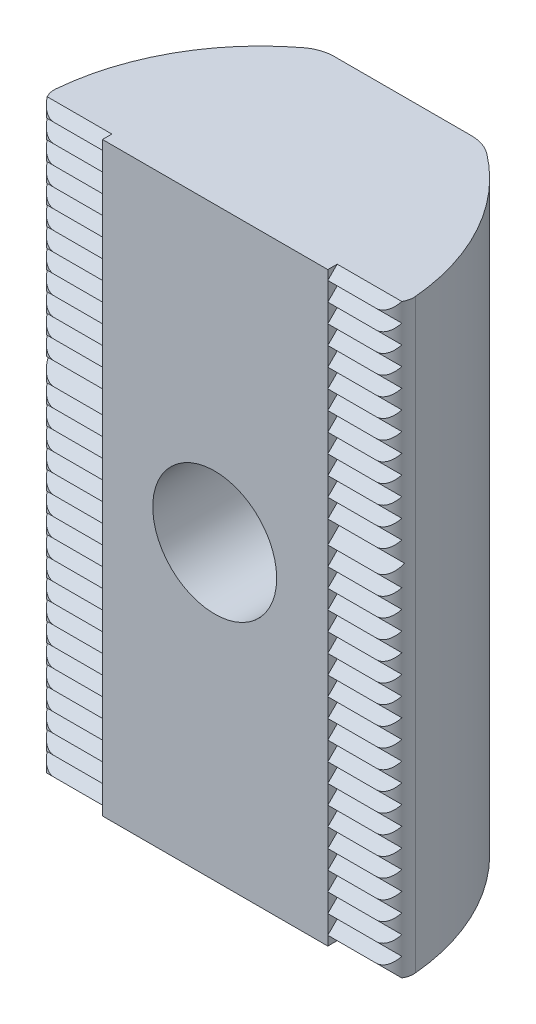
SolidWorks part; units mm, degrees
ref_plane "正面" through (0, 0, 0) normal (0, 0, 1) x (1, 0, 0)
ref_plane "平面" through (0, 0, 0) normal (0, 1, 0) x (1, 0, 0)
ref_plane "右側面" through (0, 0, 0) normal (1, 0, 0) x (0, 0, -1)
sketch "ｽｹｯﾁ1" plane through (0, 0, 0) normal (0, -1, 0) x (1, 0, 0)
  line L8 (-4.2884, 0) -> (4.2884, 0)
  line L9 (1.8306, -5) -> (-1.8306, -5)
  arc A8 (-4.7865, -0.544) -> (-2.4348, -4.7969) centre (1.1902, -0.0157) ccw
  arc A9 (-2.4348, -4.7969) -> (-1.8306, -5) centre (-1.8306, -4) ccw
  arc A10 (-4.2884, 0) -> (-4.7865, -0.544) centre (-4.2884, -0.5) ccw
  arc A11 (2.4348, -4.7969) -> (4.7865, -0.544) centre (-1.1902, -0.0157) ccw
  arc A12 (1.8306, -5) -> (2.4348, -4.7969) centre (1.8306, -4) ccw
  arc A13 (4.7865, -0.544) -> (4.2884, 0) centre (4.2884, -0.5) ccw
extrude "押し出し1" add sketch "ｽｹｯﾁ1" along normal mid plane 15.6
hole_wizard "M4x0.7 ねじ穴1" positions "ｽｹｯﾁ3" profile "ｽｹｯﾁ2" tap size "M4x0.7" standard "JIS"
sketch "ｽｹｯﾁ3" plane through (1.3374, 5.2145, 0) normal (0, 0, 1) x (1, 0, 0)
  line L1 (2.951, -13.0145) -> (-5.6258, -13.0145) construction
  line L3 (2.951, -13.0145) -> (2.951, 2.5855) construction
  point P0 (-1.349, -5.2145)
  dimension "D1" = 7.8
  dimension "D2" = 4.3
sketch "ｽｹｯﾁ2" plane through (-0.0116, 0, 0) normal (1, 0, 0) x (0, -1, 0)
  line L0 (0, 0) -> (0, 5)
  line L1 (0, 5) -> (1.65, 5)
  line L2 (1.65, 5) -> (1.65, 0)
  line L5 (1.65, 0) -> (0, 0)
  line L11 (0, -6.35) -> (0, 107.95) construction
  dimension "次ｻｰﾌｪｽまでのねじ下穴ﾄﾞﾘﾙの直径" = 3.3
  dimension "次ｻｰﾌｪｽまでのねじ下穴ﾄﾞﾘﾙの深さ" = 5
ref_plane "平面1" through (3, 0, 0) normal (1, 0, 0) x (0, 0, -1)
ref_plane "平面2" through (-3, 0, 0) normal (1, 0, 0) x (0, 0, -1)
sketch "ｽｹｯﾁ4" plane through (3, 0, 0) normal (1, 0, 0) x (0, 0, -1)
  line L0 (0.25, -7.8) -> (-2.0124, -7.8)
  line L1 (-2.0124, -7.8) -> (-2.0124, 7.8)
  line L2 (-2.0124, 7.8) -> (0.25, 7.8)
  line L3 (0, -7.05) -> (0.25, -6.8)
  line L6 (0.25, -7.3) -> (0, -7.05)
  line L7 (0.25, -7.8) -> (0, -7.55)
  line L8 (0, -7.55) -> (0.25, -7.3)
  line L9 (0, 4.55) -> (0.25, 4.8)
  line L10 (0.25, -1.3) -> (0, -1.05)
  line L13 (0.25, -4.3) -> (0, -4.05)
  line L14 (0, -6.55) -> (0.25, -6.3)
  line L15 (0.25, -6.8) -> (0, -6.55)
  line L16 (0, -4.55) -> (0.25, -4.3)
  line L17 (0.25, -5.3) -> (0, -5.05)
  line L18 (0, -6.05) -> (0.25, -5.8)
  line L19 (0.25, -6.3) -> (0, -6.05)
  line L20 (0.25, -5.8) -> (0, -5.55)
  line L21 (0, -5.55) -> (0.25, -5.3)
  line L22 (0, -5.05) -> (0.25, -4.8)
  line L23 (0.25, -4.8) -> (0, -4.55)
  line L24 (0, -2.55) -> (0.25, -2.3)
  line L25 (0.25, -3.3) -> (0, -3.05)
  line L26 (0, -4.05) -> (0.25, -3.8)
  line L27 (0.25, -3.8) -> (0, -3.55)
  line L28 (0, -3.55) -> (0.25, -3.3)
  line L29 (0, -3.05) -> (0.25, -2.8)
  line L30 (0.25, -2.8) -> (0, -2.55)
  line L31 (0, -2.05) -> (0.25, -1.8)
  line L32 (0.25, -2.3) -> (0, -2.05)
  line L33 (0.25, -1.8) -> (0, -1.55)
  line L34 (0, -1.55) -> (0.25, -1.3)
  line L37 (0, -0.55) -> (0.25, -0.3)
  line L38 (0, -1.05) -> (0.25, -0.8)
  line L39 (0.25, -0.8) -> (0, -0.55)
  line L40 (0, 1.45) -> (0.3, 1.75)
  line L41 (0.25, 0.7) -> (0, 0.95)
  line L42 (0, -0.05) -> (0.25, 0.2)
  line L43 (0.25, -0.3) -> (0, -0.05)
  line L44 (0.25, 0.2) -> (0, 0.45)
  line L45 (0, 0.45) -> (0.25, 0.7)
  line L46 (0, 0.95) -> (0.25, 1.2)
  line L47 (0.25, 1.2) -> (0, 1.45)
  line L48 (0, 3.55) -> (0.25, 3.8)
  line L49 (0.25, 2.8) -> (0, 3.05)
  line L50 (0, 2.05) -> (0.25, 2.3)
  line L51 (0.3, 1.75) -> (0, 2.05)
  line L52 (0.25, 2.3) -> (0, 2.55)
  line L53 (0, 2.55) -> (0.25, 2.8)
  line L54 (0, 3.05) -> (0.25, 3.3)
  line L55 (0.25, 3.3) -> (0, 3.55)
  line L56 (0, 4.05) -> (0.25, 4.3)
  line L57 (0.25, 3.8) -> (0, 4.05)
  line L58 (0.25, 4.3) -> (0, 4.55)
  line L60 (0.25, 7.3) -> (0, 7.55)
  line L61 (0, 5.55) -> (0.25, 5.8)
  line L62 (0.25, 4.8) -> (0, 5.05)
  line L63 (0, 5.05) -> (0.25, 5.3)
  line L64 (0.25, 5.3) -> (0, 5.55)
  line L65 (0, 7.05) -> (0.25, 7.3)
  line L66 (0.25, 6.8) -> (0, 7.05)
  line L67 (0.25, 6.3) -> (0, 6.55)
  line L68 (0, 6.55) -> (0.25, 6.8)
  line L69 (0.25, 5.8) -> (0, 6.05)
  line L70 (0, 6.05) -> (0.25, 6.3)
  line L71 (0, 7.55) -> (0.25, 7.8)
extrude "押し出し2" cut sketch "ｽｹｯﾁ4" along normal through all contours L60 L71 L2 L1 L0 L7 L8 L6 L3 L15 L14 L19 L18 L20 L21 L17 L22 L23 L16 L13 L26 L27 L28 L25 L29 L30 L24 L32 L31 L33 L34 L10 L38 L39 L37 L43 L42 L44 L45 L41 L46 L47 L40 L51 L50 L52 L53 L49 L54 L55 L48
sketch "ｽｹｯﾁ5" plane through (-3, 0, 0) normal (1, 0, 0) x (0, 0, -1)
  line L1 (-2.0124, 7.8) -> (0.25, 7.8) construction
  line L2 (-2.0124, -7.8) -> (-2.0124, 7.8) construction
  line L3 (0.25, -7.8) -> (-2.0124, -7.8) construction
  line L4 (0.25, -7.8) -> (0, -7.55) construction
  line L5 (0, -7.55) -> (0.25, -7.3) construction
  line L6 (0.25, -7.3) -> (0, -7.05) construction
  line L7 (0, -7.05) -> (0.25, -6.8) construction
  line L8 (0.25, -6.8) -> (0, -6.55) construction
  line L9 (0, -6.55) -> (0.25, -6.3) construction
  line L10 (0.25, -6.3) -> (0, -6.05) construction
  line L11 (0, -6.05) -> (0.25, -5.8) construction
  line L12 (0.25, -5.8) -> (0, -5.55) construction
  line L13 (0, -5.55) -> (0.25, -5.3) construction
  line L14 (0.25, -5.3) -> (0, -5.05) construction
  line L15 (0, -5.05) -> (0.25, -4.8) construction
  line L16 (0.25, -4.8) -> (0, -4.55) construction
  line L17 (0, -4.55) -> (0.25, -4.3) construction
  line L18 (0.25, -4.3) -> (0, -4.05) construction
  line L19 (0, -4.05) -> (0.25, -3.8) construction
  line L20 (0.25, -3.8) -> (0, -3.55) construction
  line L21 (0, -3.55) -> (0.25, -3.3) construction
  line L22 (0.25, -3.3) -> (0, -3.05) construction
  line L23 (0, -3.05) -> (0.25, -2.8) construction
  line L24 (0.25, -2.8) -> (0, -2.55) construction
  line L25 (0, -2.55) -> (0.25, -2.3) construction
  line L26 (0.25, -2.3) -> (0, -2.05) construction
  line L27 (0, -2.05) -> (0.25, -1.8) construction
  line L28 (0.25, -1.8) -> (0, -1.55) construction
  line L29 (0, -1.55) -> (0.25, -1.3) construction
  line L30 (0.25, -1.3) -> (0, -1.05) construction
  line L31 (0, -1.05) -> (0.25, -0.8) construction
  line L32 (0.25, -0.8) -> (0, -0.55) construction
  line L33 (0, -0.55) -> (0.25, -0.3) construction
  line L34 (0.25, -0.3) -> (0, -0.05) construction
  line L35 (0, -0.05) -> (0.25, 0.2) construction
  line L36 (0.25, 0.2) -> (0, 0.45) construction
  line L37 (0, 0.45) -> (0.25, 0.7) construction
  line L38 (0.25, 0.7) -> (0, 0.95) construction
  line L39 (0, 0.95) -> (0.25, 1.2) construction
  line L40 (0.25, 1.2) -> (0, 1.45) construction
  line L41 (0, 1.45) -> (0.3, 1.75) construction
  line L42 (0.3, 1.75) -> (0, 2.05) construction
  line L43 (0, 2.05) -> (0.25, 2.3) construction
  line L44 (0.25, 2.3) -> (0, 2.55) construction
  line L45 (0, 2.55) -> (0.25, 2.8) construction
  line L46 (0.25, 2.8) -> (0, 3.05) construction
  line L47 (0, 3.05) -> (0.25, 3.3) construction
  line L48 (0.25, 3.3) -> (0, 3.55) construction
  line L49 (0, 3.55) -> (0.25, 3.8) construction
  line L50 (0.25, 3.8) -> (0, 4.05) construction
  line L51 (0, 4.05) -> (0.25, 4.3) construction
  line L52 (0.25, 4.3) -> (0, 4.55) construction
  line L53 (0, 4.55) -> (0.25, 4.8) construction
  line L54 (0.25, 4.8) -> (0, 5.05) construction
  line L55 (0, 5.05) -> (0.25, 5.3) construction
  line L56 (0.25, 5.3) -> (0, 5.55) construction
  line L57 (0, 5.55) -> (0.25, 5.8) construction
  line L58 (0.25, 5.8) -> (0, 6.05) construction
  line L59 (0, 6.05) -> (0.25, 6.3) construction
  line L60 (0.25, 6.3) -> (0, 6.55) construction
  line L61 (0, 6.55) -> (0.25, 6.8) construction
  line L62 (0.25, 6.8) -> (0, 7.05) construction
  line L63 (0, 7.05) -> (0.25, 7.3) construction
  line L64 (0.25, 7.3) -> (0, 7.55) construction
  line L65 (0, 7.55) -> (0.25, 7.8) construction
  line L67 (-2.0124, 7.8) -> (0.25, 7.8)
  line L68 (-2.0124, -7.8) -> (-2.0124, 7.8)
  line L69 (0.25, -7.8) -> (-2.0124, -7.8)
  line L70 (0.25, -7.8) -> (0, -7.55)
  line L71 (0, -7.55) -> (0.25, -7.3)
  line L72 (0.25, -7.3) -> (0, -7.05)
  line L73 (0, -7.05) -> (0.25, -6.8)
  line L74 (0.25, -6.8) -> (0, -6.55)
  line L75 (0, -6.55) -> (0.25, -6.3)
  line L76 (0.25, -6.3) -> (0, -6.05)
  line L77 (0, -6.05) -> (0.25, -5.8)
  line L78 (0.25, -5.8) -> (0, -5.55)
  line L79 (0, -5.55) -> (0.25, -5.3)
  line L80 (0.25, -5.3) -> (0, -5.05)
  line L81 (0, -5.05) -> (0.25, -4.8)
  line L82 (0.25, -4.8) -> (0, -4.55)
  line L83 (0, -4.55) -> (0.25, -4.3)
  line L84 (0.25, -4.3) -> (0, -4.05)
  line L85 (0, -4.05) -> (0.25, -3.8)
  line L86 (0.25, -3.8) -> (0, -3.55)
  line L87 (0, -3.55) -> (0.25, -3.3)
  line L88 (0.25, -3.3) -> (0, -3.05)
  line L89 (0, -3.05) -> (0.25, -2.8)
  line L90 (0.25, -2.8) -> (0, -2.55)
  line L91 (0, -2.55) -> (0.25, -2.3)
  line L92 (0.25, -2.3) -> (0, -2.05)
  line L93 (0, -2.05) -> (0.25, -1.8)
  line L94 (0.25, -1.8) -> (0, -1.55)
  line L95 (0, -1.55) -> (0.25, -1.3)
  line L96 (0.25, -1.3) -> (0, -1.05)
  line L97 (0, -1.05) -> (0.25, -0.8)
  line L98 (0.25, -0.8) -> (0, -0.55)
  line L99 (0, -0.55) -> (0.25, -0.3)
  line L100 (0.25, -0.3) -> (0, -0.05)
  line L101 (0, -0.05) -> (0.25, 0.2)
  line L102 (0.25, 0.2) -> (0, 0.45)
  line L103 (0, 0.45) -> (0.25, 0.7)
  line L104 (0.25, 0.7) -> (0, 0.95)
  line L105 (0, 0.95) -> (0.25, 1.2)
  line L106 (0.25, 1.2) -> (0, 1.45)
  line L107 (0, 1.45) -> (0.3, 1.75)
  line L108 (0.3, 1.75) -> (0, 2.05)
  line L109 (0, 2.05) -> (0.25, 2.3)
  line L110 (0.25, 2.3) -> (0, 2.55)
  line L111 (0, 2.55) -> (0.25, 2.8)
  line L112 (0.25, 2.8) -> (0, 3.05)
  line L113 (0, 3.05) -> (0.25, 3.3)
  line L114 (0.25, 3.3) -> (0, 3.55)
  line L115 (0, 3.55) -> (0.25, 3.8)
  line L116 (0.25, 3.8) -> (0, 4.05)
  line L117 (0, 4.05) -> (0.25, 4.3)
  line L118 (0.25, 4.3) -> (0, 4.55)
  line L119 (0, 4.55) -> (0.25, 4.8)
  line L120 (0.25, 4.8) -> (0, 5.05)
  line L121 (0, 5.05) -> (0.25, 5.3)
  line L122 (0.25, 5.3) -> (0, 5.55)
  line L123 (0, 5.55) -> (0.25, 5.8)
  line L124 (0.25, 5.8) -> (0, 6.05)
  line L125 (0, 6.05) -> (0.25, 6.3)
  line L126 (0.25, 6.3) -> (0, 6.55)
  line L127 (0, 6.55) -> (0.25, 6.8)
  line L128 (0.25, 6.8) -> (0, 7.05)
  line L129 (0, 7.05) -> (0.25, 7.3)
  line L130 (0.25, 7.3) -> (0, 7.55)
  line L131 (0, 7.55) -> (0.25, 7.8)
extrude "押し出し3" cut sketch "ｽｹｯﾁ5" against normal through all contours L130 L131 L67 L68 L69 L70 L71 L72 L73 L74 L75 L76 L77 L78 L79 L80 L81 L82 L83 L84 L85 L86 L87 L88 L89 L90 L91 L92 L93 L94 L95 L96 L97 L98 L99 L100 L101 L102 L103 L104 L105 L106 L107 L108 L109 L110 L111 L112 L113 L114 L115
